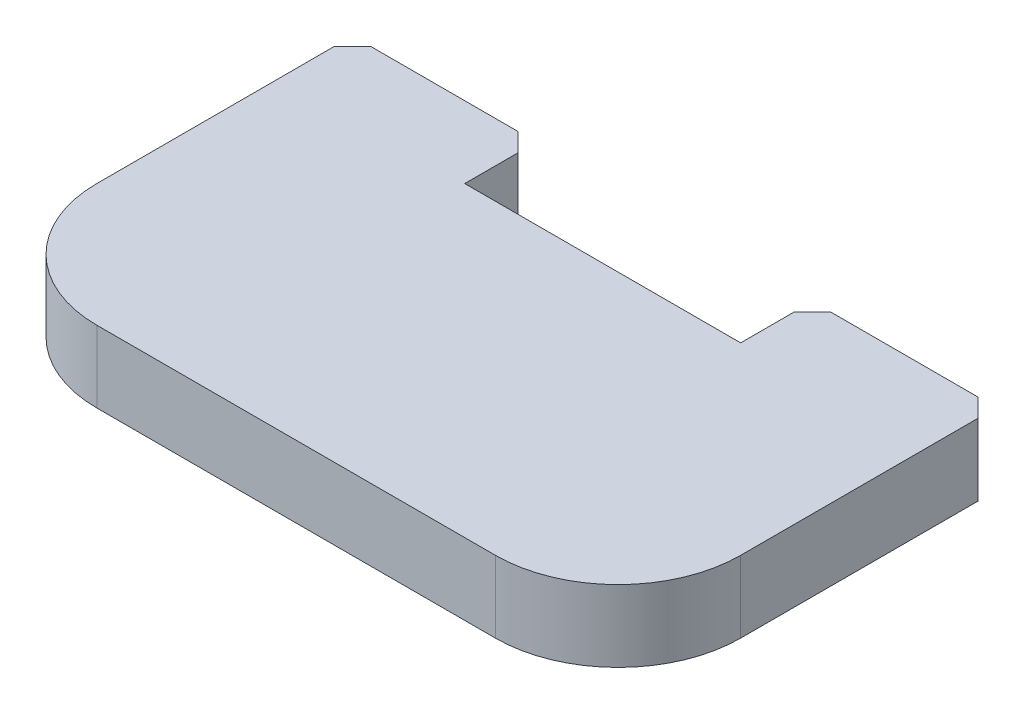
SolidWorks part; units mm, degrees
ref_plane "Front Plane" through (0, 0, 0) normal (0, 0, 1) x (1, 0, 0)
ref_plane "Top Plane" through (0, 0, 0) normal (0, 1, 0) x (1, 0, 0)
ref_plane "Right Plane" through (0, 0, 0) normal (1, 0, 0) x (0, 0, -1)
sketch "Sketch1" plane through (0, 0, 0) normal (0, 1, 0) x (1, 0, 0)
  line L1 (-13.335, 7.8359) -> (13.335, 7.8359)
  line L2 (-13.335, 7.8359) -> (-13.335, -7.8359)
  line L3 (-13.335, -7.8359) -> (13.335, -7.8359)
  line L4 (13.335, 7.8359) -> (13.335, -7.8359)
  line L5 (-13.335, 7.8359) -> (13.335, -7.8359) construction
  line L6 (-13.335, -7.8359) -> (13.335, 7.8359) construction
  point P0 (0, 0)
extrude "Boss-Extrude1" add sketch "Sketch1" along normal blind 2.9718
sketch "Sketch2" plane through (0, 2.9718, 0) normal (0, 1, 0) x (1, 0, 0)
  line L0 (13.335, 7.8359) -> (-13.335, 7.8359) construction
  line L1 (-5.715, 10.8077) -> (5.715, 10.8077)
  line L2 (-5.715, 10.8077) -> (-5.715, 4.8641)
  line L3 (-5.715, 4.8641) -> (5.715, 4.8641)
  line L4 (5.715, 10.8077) -> (5.715, 4.8641)
  line L5 (-5.715, 10.8077) -> (5.715, 4.8641) construction
  line L6 (-5.715, 4.8641) -> (5.715, 10.8077) construction
  point P0 (0, 7.8359)
extrude "Cut-Extrude1" cut sketch "Sketch2" against normal through all
chamfer "Chamfer1" distance 0.762 4 edges at (13.335, 1.4859, -7.8359) (5.715, 1.4859, -7.8359) (-13.335, 1.4859, -7.8359) (-5.715, 1.4859, -7.8359)
fillet "Fillet1" radius 5.08 2 edges at (13.335, 1.4859, 7.8359) (-13.335, 1.4859, 7.8359)
sketch "Sketch3" plane through (0, 2.9718, 0) normal (0, 1, 0) x (1, 0, 0)
  line L24 (-8.255, -7.9375) -> (8.255, -7.9375)
  line L25 (13.4366, -2.7559) -> (13.4366, 7.116)
  line L26 (13.4366, 7.116) -> (12.6151, 7.9375)
  line L27 (12.6151, 7.9375) -> (6.4349, 7.9375)
  line L28 (6.4349, 7.9375) -> (5.6134, 7.116)
  line L29 (5.6134, 7.116) -> (5.6134, 4.9657)
  line L30 (5.6134, 4.9657) -> (-5.6134, 4.9657)
  line L31 (-5.6134, 4.9657) -> (-5.6134, 7.116)
  line L32 (-5.6134, 7.116) -> (-6.4349, 7.9375)
  line L33 (-6.4349, 7.9375) -> (-12.6151, 7.9375)
  line L34 (-12.6151, 7.9375) -> (-13.4366, 7.116)
  line L35 (-13.4366, 7.116) -> (-13.4366, -2.7559)
  line L36 (-8.255, -7.9375) -> (8.255, -7.9375)
  line L37 (13.4366, -2.7559) -> (13.4366, 7.116)
  line L38 (13.4366, 7.116) -> (12.6151, 7.9375)
  line L39 (12.6151, 7.9375) -> (6.4349, 7.9375)
  line L40 (6.4349, 7.9375) -> (5.6134, 7.116)
  line L41 (5.6134, 7.116) -> (5.6134, 4.9657)
  line L42 (5.6134, 4.9657) -> (-5.6134, 4.9657)
  line L43 (-5.6134, 4.9657) -> (-5.6134, 7.116)
  line L44 (-5.6134, 7.116) -> (-6.4349, 7.9375)
  line L45 (-6.4349, 7.9375) -> (-12.6151, 7.9375)
  line L46 (-12.6151, 7.9375) -> (-13.4366, 7.116)
  line L47 (-13.4366, 7.116) -> (-13.4366, -2.7559)
  arc A4 (8.255, -7.9375) -> (13.4366, -2.7559) centre (8.255, -2.7559) ccw
  arc A5 (-13.4366, -2.7559) -> (-8.255, -7.9375) centre (-8.255, -2.7559) ccw
  arc A6 (8.255, -7.9375) -> (13.4366, -2.7559) centre (8.255, -2.7559) ccw
  arc A7 (-13.4366, -2.7559) -> (-8.255, -7.9375) centre (-8.255, -2.7559) ccw
equation "\"D1@Sketch1\"=2*(.375+.300/2)"
equation "\"D2@Sketch1\"=.5 + \"t\""
equation "\"D1@Boss-Extrude1\"=\"t\""
equation "\"t\" = .117in'plywood thickness"
equation "\"D1@Sketch2\"=2*(.375-.3/2)"
equation "\"D2@Sketch2\"=\"t\"*2"
equation "\"kerf\"= .004in'Kerf for laser cutter"
equation "\"D1@Sketch3\"=\"kerf\""
